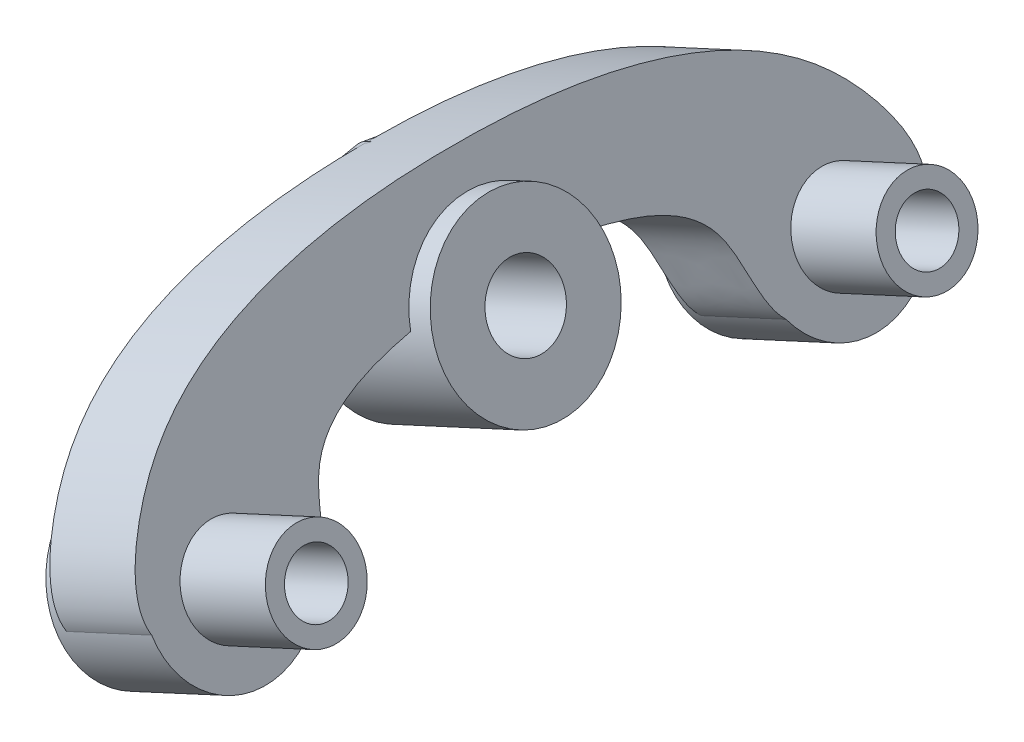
SolidWorks part; units mm, degrees
ref_plane "Alzado" through (0, 0, 0) normal (0, 0, 1) x (1, 0, 0)
ref_plane "Planta" through (0, 0, 0) normal (0, 1, 0) x (1, 0, 0)
ref_plane "Vista lateral" through (0, 0, 0) normal (1, 0, 0) x (0, 0, -1)
sketch3d "Sk_puntos_Plano_puente"
  point P0 (429.5, 386.8, 0)
  point P1 (446.2623, 350.4816, 0)
  point P2 (429.5, 386.8, 40)
ref_plane "Plano_puente" through (501.2483, 231.3454, 0) normal (-0.908, -0.4191, 0) x (0, 0, 1)
sketch "Sk_Arco" plane through (501.2483, 231.3454, 0) normal (-0.908, -0.4191, 0) x (0, 0, 1)
  spline S0 degree 3 poles (-18.2045, 160.2191) (-36.14, 164.3802) (-30.9281, 175.4838) (-23.7009, 181.126) (-12.5145, 184.2504) (0, 184.9587) (12.5145, 184.2504) (23.7009, 181.126) (30.9281, 175.4838) (36.14, 164.3802) (18.2045, 160.2191) (18.3333, 172.4724) (9.189, 175.8899) (0, 176.3926) (-9.189, 175.8899) (-18.3333, 172.4724) (-18.2045, 160.2191) (-36.14, 164.3802) (-30.9281, 175.4838) knots -0.181031 -0.130737 -0.083228 0 0.045415 0.102929 0.174939 0.256275 0.337612 0.409622 0.467136 0.512551 0.595779 0.643288 0.693582 0.756275 0.818969 0.869263 0.916772 1 1.045415 1.102929 1.174939 only from (-33, 167.2132) to (-33, 167.2132)
extrude "Arco" add sketch "Sk_Arco" along normal mid plane 8
sketch3d "Sk_Nervio"
  line L0 (422.0966, 393.2954, -14) -> (421.2585, 395.1113, 0)
  line L1 (421.2585, 395.1113, 0) -> (422.0966, 393.2954, 14)
  dimension "D1" = 14.1421
  dimension "D2" = 14.1421
sweep "Nervio" add path "Sk_Nervio" parameters "D3"=5
sketch3d "Sk_Buje_central"
  line L0 (422.7951, 387.0095, 0) -> (433.6906, 392.0382, 0)
  dimension "D1" = 12
sweep "Buje_central" add path "Sk_Buje_central" parameters "D3"=15
sketch3d "Sk_Buje_pivote_izq"
  line L0 (426.4269, 381.5269, -26) -> (434.5985, 385.2984, -26)
  dimension "D1" = 9
sweep "Buje_pivote_izq" add path "Sk_Buje_pivote_izq" parameters "D3"=14
sketch3d "Sk_Pivote_izq"
  line L0 (434.5985, 385.2984, -26) -> (441.8622, 388.6508, -26)
  dimension "D1" = 8
sweep "Pivote_izq" add path "Sk_Pivote_izq" parameters "D3"=8
sketch3d "Sk_Tope_muelle_izq"
  line L0 (425.1697, 391.4096, -16.12) -> (425.1697, 391.4096, -19.12)
  line L1 (425.1697, 391.4096, -19.12) -> (419.722, 388.8953, -19.12)
  dimension "D1" = 3
  dimension "D2" = 6
sweep "Tope_muelle_izq" add path "Sk_Tope_muelle_izq" parameters "D3"=2.5
sketch3d "Sk_Buje_pivote_dcho"
  line L0 (426.4269, 381.5269, 26) -> (434.5985, 385.2984, 26)
  dimension "D1" = 9
sweep "Buje_pivote_dcho" add path "Sk_Buje_pivote_dcho" parameters "D3"=14
sketch3d "Sk_Pivote_dcho"
  line L0 (434.5985, 385.2984, 26) -> (441.8622, 388.6508, 26)
  dimension "D1" = 8
sweep "Pivote_dcho" add path "Sk_Pivote_dcho" parameters "D3"=8
sketch3d "Sk_Tope_muelle_dcho"
  line L0 (425.1697, 391.4096, 16.12) -> (425.1697, 391.4096, 19.12)
  line L1 (425.1697, 391.4096, 19.12) -> (419.722, 388.8953, 19.12)
  dimension "D1" = 3
  dimension "D2" = 6
sweep "Tope_muelle_dcho" add path "Sk_Tope_muelle_dcho" parameters "D3"=2.5
sketch3d "Sk_Taladro_central"
  line L0 (420.9792, 386.1714, 0) -> (435.5065, 392.8763, 0)
  dimension "D1" = 16
sweep "Taladro_central" cut path "Sk_Taladro_central" parameters "D3"=6.4
sketch3d "Sk_Rosca_pivote_izq"
  line L0 (425.5189, 381.1078, -26) -> (442.7702, 389.0699, -26)
  dimension "D1" = 19
sweep "Rosca_pivote_izq" cut path "Sk_Rosca_pivote_izq" parameters "D3"=5
sketch3d "Sk_Rosca_pivote_dcho"
  line L0 (425.5189, 381.1078, 26) -> (442.7702, 389.0699, 26)
  dimension "D1" = 19
sweep "Rosca_pivote_dcho" cut path "Sk_Rosca_pivote_dcho" parameters "D3"=5
sketch3d "Sk_puntos_Plano_tiro_ref"
  point P0 (429.5, 386.8, 0)
  point P1 (465.8184, 403.5623, 0)
  point P2 (429.5, 386.8, 40)
ref_plane "Plano_tiro_ref" through (-71.7483, 155.4546, 0) normal (0.4191, -0.908, 0) x (-0.908, -0.4191, 0)
